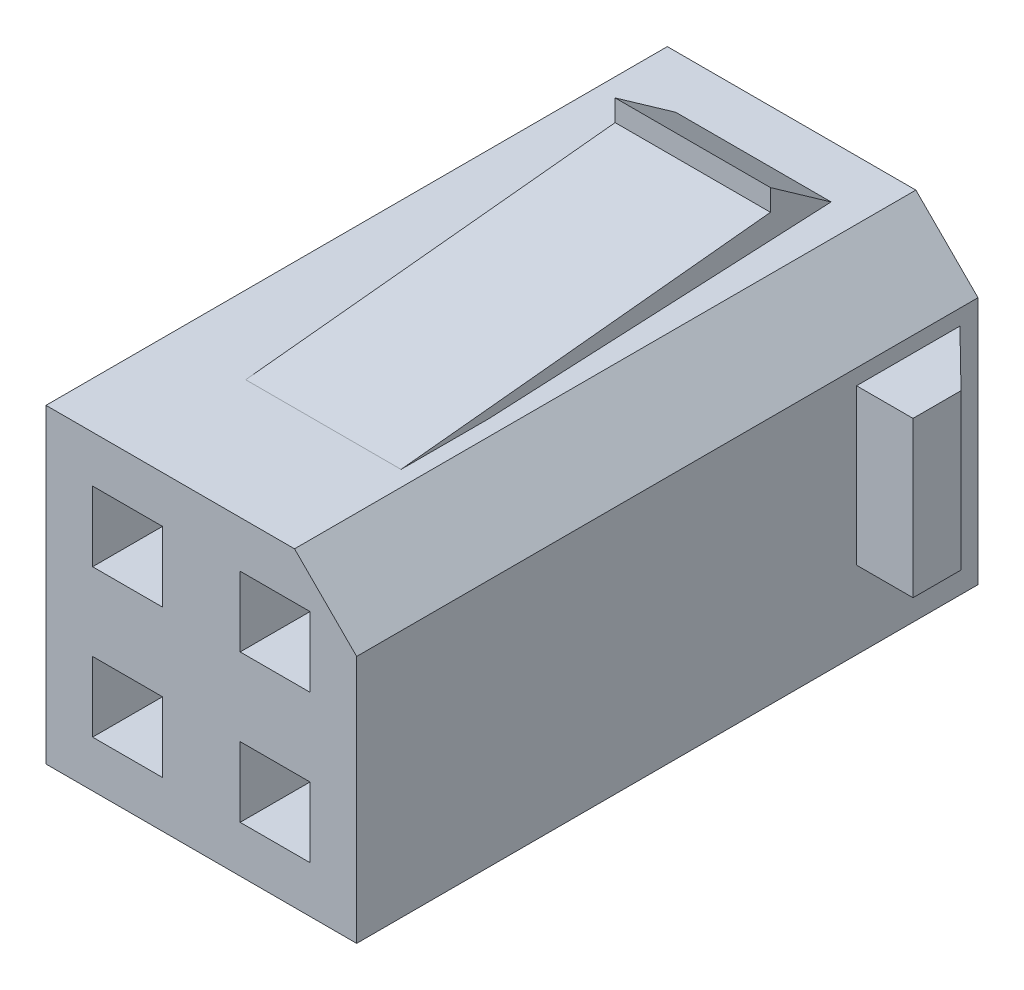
SolidWorks part; units mm, degrees
ref_plane "Face" through (0, 0, 0) normal (0, 0, 1) x (1, 0, 0)
ref_plane "Dessus" through (0, 0, 0) normal (0, 1, 0) x (1, 0, 0)
ref_plane "Droite" through (0, 0, 0) normal (1, 0, 0) x (0, 0, -1)
sketch "Esquisse1" plane through (0, 0, 0) normal (0, 0, 1) x (1, 0, 0)
  line L0 (-5, 5) -> (-5, -5)
  line L1 (-5, -5) -> (5, -5)
  line L2 (5, -5) -> (5, 3)
  line L3 (5, 3) -> (3, 5)
  line L4 (3, 5) -> (-5, 5)
  line L5 (2.7929, 4.5) -> (4.5, 2.7929)
  line L6 (-4.5, 4.5) -> (-0.25, 4.5)
  line L7 (-4.5, 4.5) -> (-4.5, 0.25)
  line L8 (-4.5, 0.25) -> (-0.25, 0.25)
  line L9 (-0.25, 4.5) -> (-0.25, 0.25)
  line L10 (-4.5, -0.25) -> (-0.25, -0.25)
  line L11 (-4.5, -0.25) -> (-4.5, -4.5)
  line L12 (-4.5, -4.5) -> (-0.25, -4.5)
  line L13 (-0.25, -0.25) -> (-0.25, -4.5)
  line L14 (0.25, -0.25) -> (4.5, -0.25)
  line L15 (0.25, -0.25) -> (0.25, -4.5)
  line L16 (0.25, -4.5) -> (4.5, -4.5)
  line L17 (4.5, -0.25) -> (4.5, -4.5)
  line L18 (0.25, 4.5) -> (2.7929, 4.5)
  line L19 (0.25, 4.5) -> (0.25, 0.25)
  line L20 (0.25, 0.25) -> (4.5, 0.25)
  line L21 (4.5, 2.7929) -> (4.5, 0.25)
  dimension "D1" = 10
  dimension "D2" = 10
  dimension "D3" = 5
  dimension "D4" = 5
  dimension "D5" = 135
  dimension "D6" = 2
  dimension "D7" = 0.5
  dimension "D8" = 0.5
  dimension "D9" = 0.5
  dimension "D10" = 0.5
  dimension "D11" = 0.5
  dimension "D12" = 0.25
  dimension "D13" = 0.5
  dimension "D14" = 0.25
  dimension "D15" = 0.5
extrude "Extrusion1" add sketch "Esquisse1" along normal blind 15
sketch "Esquisse2" plane through (0, 0, 15) normal (0, 0, 1) x (1, 0, 0)
  line L0 (-5, 5) -> (-5, -5)
  line L1 (-5, -5) -> (5, -5)
  line L2 (5, -5) -> (5, 3)
  line L3 (5, 3) -> (3, 5)
  line L4 (3, 5) -> (-5, 5)
  line L5 (-0.25, 4.5) -> (-4.5, 4.5) construction
  line L6 (-3.5, 3.5) -> (-1.25, 3.5)
  line L7 (-3.5, 3.5) -> (-3.5, 1.25)
  line L8 (-3.5, 1.25) -> (-1.25, 1.25)
  line L9 (-1.25, 3.5) -> (-1.25, 1.25)
  line L10 (1.25, 3.5) -> (3.5, 3.5)
  line L11 (1.25, 3.5) -> (1.25, 1.25)
  line L12 (1.25, 1.25) -> (3.5, 1.25)
  line L13 (3.5, 3.5) -> (3.5, 1.25)
  line L14 (-3.5, -1.25) -> (-1.25, -1.25)
  line L15 (-3.5, -1.25) -> (-3.5, -3.5)
  line L16 (-3.5, -3.5) -> (-1.25, -3.5)
  line L17 (-1.25, -1.25) -> (-1.25, -3.5)
  line L18 (1.25, -1.25) -> (3.5, -1.25)
  line L19 (1.25, -1.25) -> (1.25, -3.5)
  line L20 (1.25, -3.5) -> (3.5, -3.5)
  line L21 (3.5, -1.25) -> (3.5, -3.5)
  line L22 (-4.5, 0.25) -> (-0.25, 0.25) construction
  line L23 (-4.5, 4.5) -> (-4.5, 0.25) construction
  line L24 (-0.25, 0.25) -> (-0.25, 4.5) construction
  line L25 (0.25, 4.5) -> (0.25, 0.25) construction
  line L27 (-0.25, -0.25) -> (-4.5, -0.25) construction
  dimension "D1" = 1
  dimension "D2" = 1
  dimension "D3" = 1
  dimension "D4" = 1
  dimension "D5" = 1
  dimension "D6" = 1
extrude "Extrusion2" add sketch "Esquisse2" along normal blind 5
sketch "Esquisse3" plane through (0, 0, 0) normal (0, 1, 0) x (1, 0, 0)
  line L0 (5, -0.5823) -> (6.8182, -2.3648)
  line L1 (5, -20) -> (5, 0) construction
  line L2 (6.8182, -2.3648) -> (6.8182, -3.9097)
  line L3 (6.8182, -3.9097) -> (5, -3.9097)
  line L4 (5, -3.9097) -> (5, -0.5823)
extrude "Extrusion3" add sketch "Esquisse3" along normal mid plane 5
sketch "Esquisse4" plane through (0, 0, 0) normal (1, 0, 0) x (0, 0, -1)
  line L0 (-16.0721, 5) -> (-4.1804, 6.2213)
  line L1 (-20, 5) -> (0, 5) construction
  line L2 (-4.1804, 6.2213) -> (-4.1804, 6.91)
  line L3 (-4.1804, 6.91) -> (-2.2284, 5.5336)
  line L4 (-16.0721, 5) -> (-13.2484, 5)
  line L5 (-13.2484, 5) -> (-2.2284, 5.5336)
  line L6 (-16.0721, -5) -> (-13.2484, -5)
  line L7 (-13.2484, -5) -> (-2.2284, -5.5593)
  line L8 (-16.0721, -5) -> (-4.1804, -6.2902)
  line L9 (-20, -5) -> (0, -5) construction
  line L10 (-4.1804, -6.2902) -> (-4.1804, -7.0018)
  line L11 (-4.1804, -7.0018) -> (-2.2284, -5.5593)
extrude "Extrusion4" add sketch "Esquisse4" along normal mid plane 5
